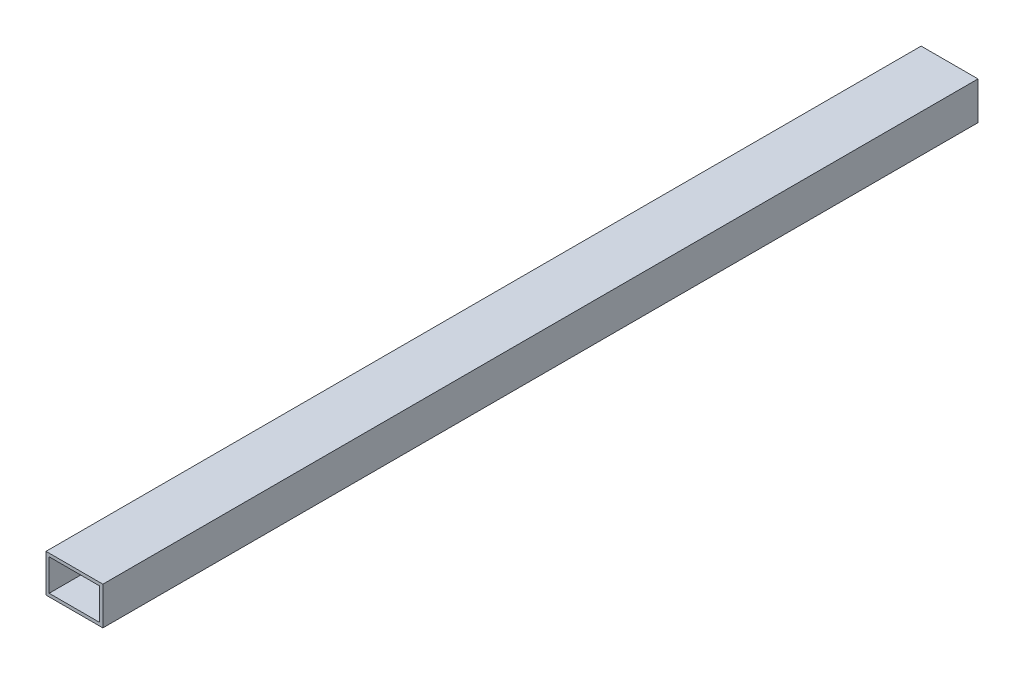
SolidWorks part; units mm, degrees
ref_plane "Front Plane" through (0, 0, 0) normal (0, 0, 1) x (1, 0, 0)
ref_plane "Top Plane" through (0, 0, 0) normal (0, 1, 0) x (1, 0, 0)
ref_plane "Right Plane" through (0, 0, 0) normal (1, 0, 0) x (0, 0, -1)
sketch "Sketch1" plane through (0, 0, 0) normal (0, 0, 1) x (1, 0, 0)
  line L1 (-127, -6.35) -> (-241.3, -6.35)
  line L2 (-127, -6.35) -> (-127, -82.55)
  line L3 (-127, -82.55) -> (-241.3, -82.55)
  line L4 (-241.3, -6.35) -> (-241.3, -82.55)
  line L5 (-127, -6.35) -> (-241.3, -82.55) construction
  line L6 (-127, -82.55) -> (-241.3, -6.35) construction
  line L7 (-127, -44.45) -> (0, -41.275) construction
  line L12 (-133.35, -12.7) -> (-234.95, -12.7)
  line L13 (-234.95, -12.7) -> (-234.95, -76.2)
  line L14 (-133.35, -76.2) -> (-234.95, -76.2)
  line L15 (-133.35, -12.7) -> (-133.35, -76.2)
  point P4 (-184.15, -44.45)
  dimension "D1" = 114.3
  dimension "D2" = 76.2
  dimension "D4" = 127
  dimension "D3" = 6.35
extrude "Boss-Extrude1" add sketch "Sketch1" along normal up to surface (1758.95 mm away)
